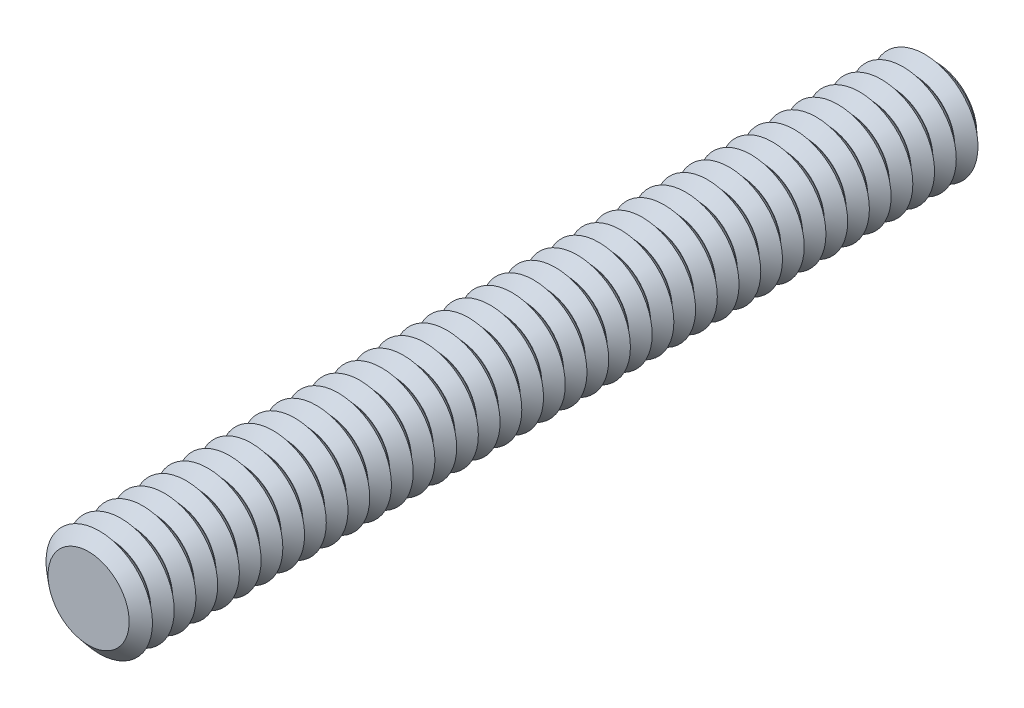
SolidWorks part; units mm, degrees
ref_plane "Front" through (0, 0, 0) normal (0, 0, 1) x (1, 0, 0)
ref_plane "Top" through (0, 0, 0) normal (0, 1, 0) x (1, 0, 0)
ref_plane "Right" through (0, 0, 0) normal (1, 0, 0) x (0, 0, -1)
sketch "Sketch1" plane through (0, 0, 0) normal (0, 0, 1) x (1, 0, 0)
  circle A0 centre (0, 0) radius 2.4193
  dimension "D1" = 4.8387
extrude "Extrude1" add sketch "Sketch1" against normal blind 50.546
sketch "Sketch2" plane through (0, 0, 0) normal (1, 0, 0) x (0, 0, -1)
  line L0 (0, 2.4193) -> (0.635, 3.175)
  line L1 (0.635, 3.175) -> (1.27, 2.4193)
  line L2 (50.546, 2.4193) -> (0, 2.4193) construction
  line L3 (1.27, 2.4193) -> (0, 2.4193)
  line L4 (0, 0) -> (-0.665, 0) construction
  dimension "D1" = 1.27
  dimension "D2" = 6.35
revolve "Revolve1" add sketch "Sketch2" angle 360 about L4
pattern_linear "LPattern1" count 39 spacing 1.2954 along (0, 0, -1) of "Revolve1"
